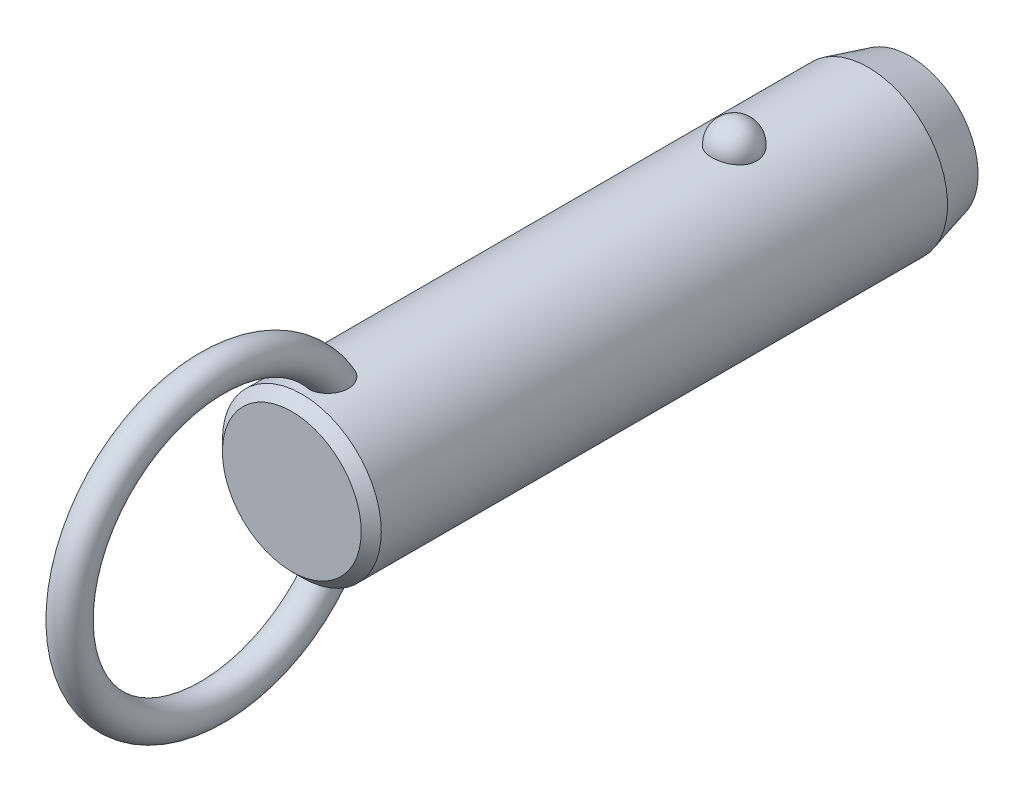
SolidWorks part; units mm, degrees
ref_plane "Front Plane" through (0, 0, 0) normal (0, 0, 1) x (1, 0, 0)
ref_plane "Top Plane" through (0, 0, 0) normal (0, 1, 0) x (1, 0, 0)
ref_plane "Right Plane" through (0, 0, 0) normal (1, 0, 0) x (0, 0, -1)
sketch "Sketch2" plane through (0, 0, 0) normal (0, 0, 1) x (1, 0, 0)
  circle A0 centre (0, 0) radius 9.5
  point P3 (0, 9.5)
  dimension "D1" = 19
extrude "Boss-Extrude1" add sketch "Sketch2" along normal blind 40.7
sketch "Sketch3" plane through (0, 0, 0) normal (0, 0, -1) x (-1, 0, 0)
  circle A0 centre (0, 0) radius 9.5
  dimension "D1" = 19
extrude "Boss-Extrude2" add sketch "Sketch3" along normal blind 23.7
chamfer "Chamfer1" distance 5 angle 15 1 edges at (-9.5, 0, -23.7)
sketch "Sketch12" plane through (0, 0, 0) normal (1, 0, 0) x (0, 0, -1)
  line L0 (-40.7, 9.5) -> (-40.7, -9.5) construction
  point P0 (-40.7, 0)
sketch "Sketch13" plane through (0, 0, 0) normal (1, 0, 0) x (0, 0, -1)
  circle A0 centre (-59.75, 0) radius 19.05
  point P2 (-40.7, 0)
  dimension "D1" = 38.1
sketch "Sketch14" plane through (0, 0, 0) normal (0, 1, 0) x (1, 0, 0)
  circle A0 centre (0, -42.7) radius 2
  point P2 (0, -40.7)
  dimension "D1" = 4
sweep "Sweep1" add profiles "Sketch14" path "Sketch13"
sketch "Sketch15" plane through (0, 0, 40.7) normal (0, 0, 1) x (1, 0, 0)
  circle A0 centre (0, 0) radius 9.5
  dimension "D1" = 19
extrude "Boss-Extrude3" add sketch "Sketch15" along normal blind 9.52
chamfer "Chamfer2" distance 1.2 angle 45 1 edges at (9.5, 0, 50.22)
sketch "Sketch18" plane through (0, 0, 0) normal (1, 0, 0) x (0, 0, -1)
  line L0 (18.7, 9.5) -> (-43.2378, 9.5) construction
  line L1 (2.7, 12.2) -> (2.7, 6.8)
  line L2 (-43.2378, -9.5) -> (18.7, -9.5) construction
  arc A0 (2.7, 12.2) -> (2.7, 6.8) centre (2.7, 9.5) ccw
  point P4 (0, 9.5)
  dimension "D1" = 21.7
revolve "Revolve1" add sketch "Sketch18" angle 360 about L1
